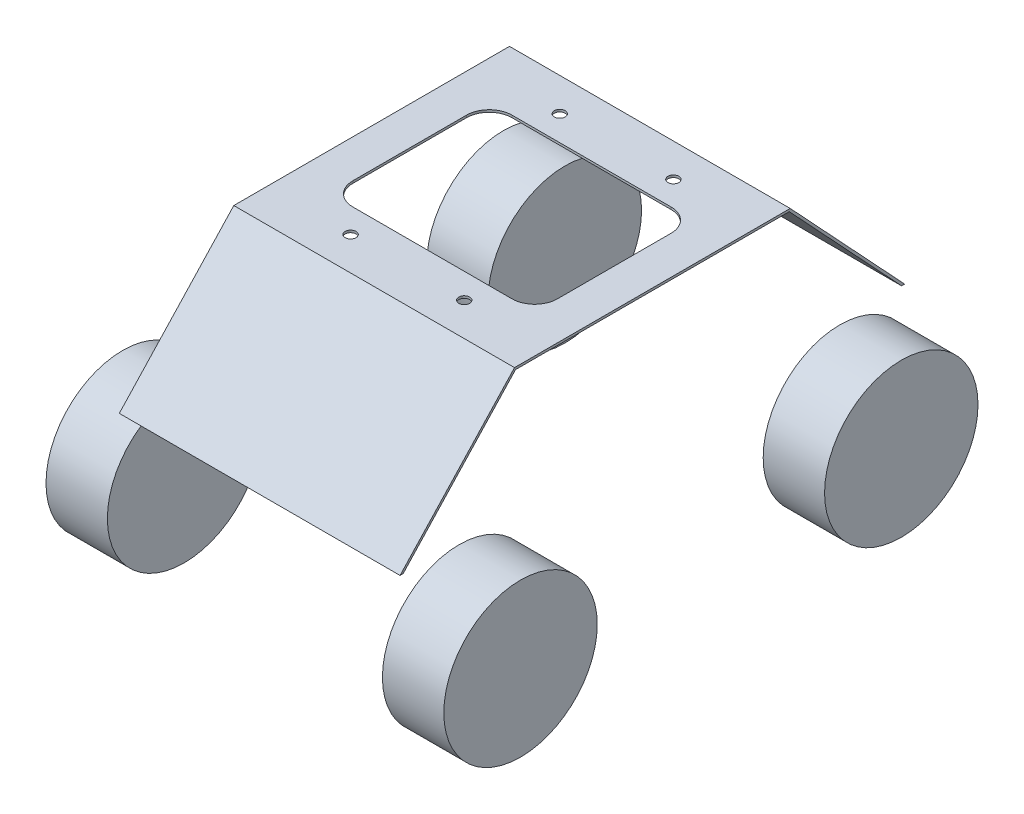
SolidWorks part; units mm, degrees
ref_plane "Plano frontal" through (0, 0, 0) normal (0, 0, 1) x (1, 0, 0)
ref_plane "Plano superior" through (0, 0, 0) normal (0, 1, 0) x (1, 0, 0)
ref_plane "Plano direito" through (0, 0, 0) normal (1, 0, 0) x (0, 0, -1)
sketch "Esboço1" plane through (0, 0, 0) normal (0, 1, 0) x (1, 0, 0)
  line L1 (-87.5, 117.5) -> (87.5, 117.5)
  line L2 (-87.5, 117.5) -> (-87.5, -117.5)
  line L3 (-87.5, -117.5) -> (87.5, -117.5)
  line L4 (87.5, 117.5) -> (87.5, -117.5)
  line L5 (-87.5, 117.5) -> (87.5, -117.5) construction
  line L6 (-87.5, -117.5) -> (87.5, 117.5) construction
  point P0 (0, 0)
  dimension "D1" = 175
  dimension "D2" = 235
extrude "Ressalto-extrusão1" add sketch "Esboço1" along normal blind 67.5
fillet "Filete1" radius 33.75 4 edges at (0, 0, -117.5) (0, 67.5, -117.5) (0, 0, 117.5) (0, 67.5, 117.5)
sketch "Esboço2" plane through (87.5, 0, 0) normal (1, 0, 0) x (0, 0, -1)
  line L0 (-83.75, 67.5) -> (83.75, 67.5)
  line L1 (83.75, 67.5) -> (83.75, 0) construction
  line L2 (83.75, 0) -> (-83.75, 0)
  line L3 (-83.75, 0) -> (-83.75, 67.5) construction
  circle A0 centre (-83.75, 33.75) radius 33.75 construction
  circle A1 centre (83.75, 33.75) radius 33.75 construction
  arc A2 (-83.75, 67.5) -> (-83.75, 0) centre (-83.75, 33.75) cw
  arc A3 (83.75, 67.5) -> (83.75, 0) centre (83.75, 33.75) ccw
extrude "Corte-extrusão1" cut sketch "Esboço2" against normal through all
sketch "Esboço3" plane through (0, 0, 0) normal (0, 0, 1) x (1, 0, 0)
  line L0 (87.5, 33.75) -> (-87.5, 33.75) construction
  line L1 (-60.5, 67.5) -> (60.5, 67.5)
  line L2 (-60.5, 67.5) -> (-60.5, 0)
  line L3 (-60.5, 0) -> (60.5, 0)
  line L4 (60.5, 67.5) -> (60.5, 0)
  line L5 (-60.5, 67.5) -> (60.5, 0) construction
  line L6 (-60.5, 0) -> (60.5, 67.5) construction
  line L7 (-87.5, 0) -> (87.5, 0) construction
  line L8 (87.5, 0) -> (87.5, 67.5) construction
  point P0 (0, 33.75)
  dimension "D1" = 27
extrude "Corte-extrusão2" cut sketch "Esboço3" against normal through all and the other way through all
ref_plane "Plano1" through (0, 70, 0) normal (0, 1, 0) x (1, 0, 0)
sketch "Esboço4" plane through (0, 70, 0) normal (0, 1, 0) x (1, 0, 0)
  line L1 (-61.75, 111) -> (61.75, 111)
  line L2 (-61.75, 111) -> (-61.75, -111)
  line L3 (-61.75, -111) -> (61.75, -111)
  line L4 (61.75, 111) -> (61.75, -111)
  line L5 (-61.75, 111) -> (61.75, -111) construction
  line L6 (-61.75, -111) -> (61.75, 111) construction
  point P0 (0, 0)
  dimension "D1" = 123.5
  dimension "D2" = 222
extrude "Ressalto-extrusão2" add sketch "Esboço4" along normal blind 54 separate body
sketch "Esboço6" plane through (61.75, 0, 0) normal (1, 0, 0) x (0, 0, -1)
  line L0 (-111, 70) -> (-111, 124)
  line L1 (-111, 124) -> (-60.6442, 124)
  line L2 (-111, 124) -> (111, 124) construction
  line L3 (-60.6442, 124) -> (-111, 70)
  line L4 (111, 124) -> (111, 70)
  line L5 (111, 70) -> (60.6442, 124)
  line L6 (60.6442, 124) -> (111, 124)
  line L7 (-109.6327, 70) -> (-60.2094, 123)
  line L8 (-111, 70) -> (111, 70) construction
  line L9 (-60.2094, 123) -> (60.2094, 123)
  line L10 (60.2094, 123) -> (109.6327, 70)
  line L11 (109.6327, 70) -> (-109.6327, 70)
  dimension "D1" = 43
  dimension "D2" = 1
  dimension "D3" = 1
  dimension "D4" = 1
extrude "Corte-extrusão3" cut sketch "Esboço6" against normal through all
sketch "Esboço7" plane through (0, 124, 0) normal (0, 1, 0) x (1, 0, 0)
  line L0 (-25, 46) -> (-25, -46) construction
  line L1 (-35, 35) -> (35, 35)
  line L2 (-45, 25) -> (-45, -25)
  line L3 (-35, -35) -> (35, -35)
  line L4 (45, 25) -> (45, -25)
  line L5 (-45, 35) -> (45, -35) construction
  line L6 (-45, -35) -> (45, 35) construction
  line L7 (-25, 46) -> (25, 46) construction
  line L8 (-25, -46) -> (25, -46) construction
  line L9 (25, 46) -> (25, -46) construction
  line L10 (-25, -46) -> (25, 46) construction
  line L11 (-25, 46) -> (25, -46) construction
  arc A0 (35, -35) -> (45, -25) centre (35, -25) ccw
  arc A1 (-45, -25) -> (-35, -35) centre (-35, -25) ccw
  arc A2 (35, 35) -> (45, 25) centre (35, 25) cw
  arc A3 (-35, 35) -> (-45, 25) centre (-35, 25) ccw
  circle A4 centre (-25, -46) radius 2.4
  circle A5 centre (25, -46) radius 2.4
  circle A6 centre (-25, 46) radius 2.4
  circle A7 centre (25, 46) radius 2.4
  point P0 (0, 0)
  dimension "D3" = 10
  dimension "D6" = 4.8
  dimension "D1" = 70
  dimension "D2" = 90
  dimension "D4" = 92
  dimension "D5" = 50
extrude "Corte-extrusão4" cut sketch "Esboço7" against normal through all
